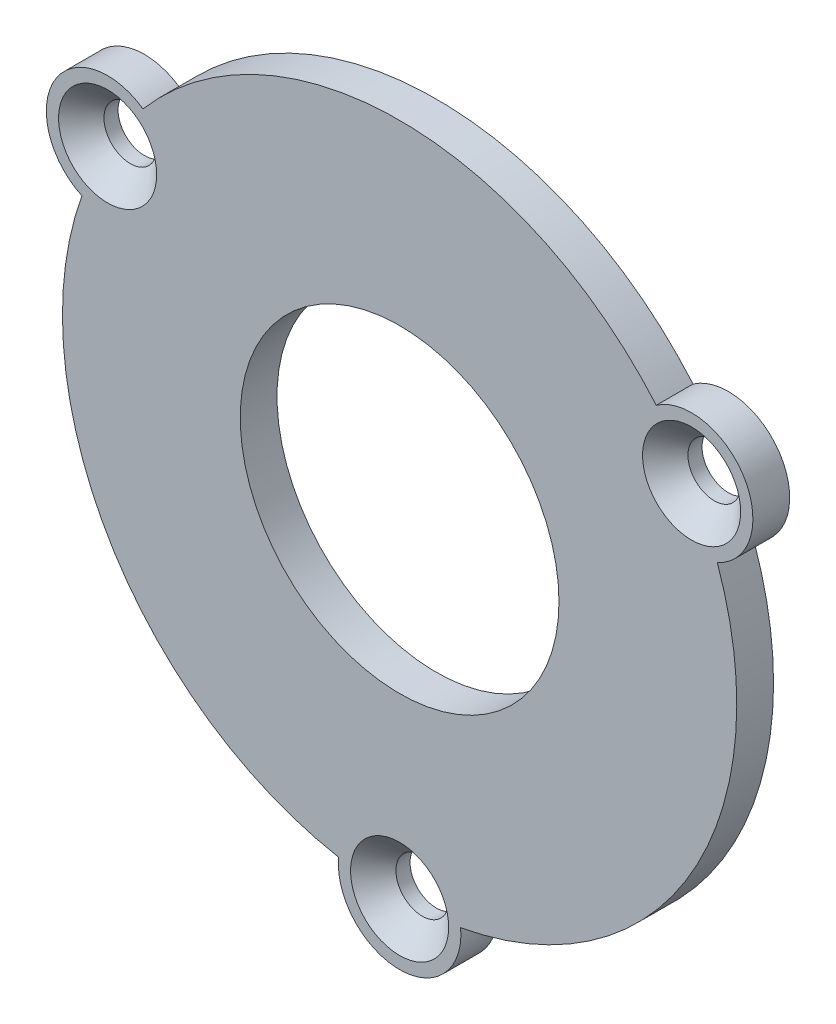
SolidWorks part; units mm, degrees
ref_plane "Plan de face" through (0, 0, 0) normal (0, 0, 1) x (1, 0, 0)
ref_plane "Plan de dessus" through (0, 0, 0) normal (0, 1, 0) x (1, 0, 0)
ref_plane "Plan de droite" through (0, 0, 0) normal (1, 0, 0) x (0, 0, -1)
sketch "Esquisse1" plane through (0, 0, 0) normal (0, 0, 1) x (1, 0, 0)
  circle A0 centre (0, 0) radius 27.5
  circle A1 centre (0, 0) radius 13
  dimension "D1" = 26
  dimension "D2" = 55
extrude "Extrusion1" add sketch "Esquisse1" along normal blind 3
sketch "Esquisse4" plane through (0, 0, 0) normal (0, 0, 1) x (1, 0, 0)
  circle A0 centre (0, -27.5) radius 5
  circle A1 centre (0, 0) radius 27.5 construction
  dimension "D1" = 10
extrude "Extrusion2" add sketch "Esquisse4" along normal up to surface (3 mm away)
hole_wizard "Fraisage pour vis à tête fraisée M42" positions "Esquisse6" profile "Esquisse5" countersink size "M4" standard "Ansi Métrique"
sketch "Esquisse6" plane through (0, 0, 3) normal (0, 0, 1) x (1, 0, 0)
  arc A0 (-4.9793, -27.0455) -> (4.9793, -27.0455) centre (0, -27.5) ccw construction
  point P0 (0, -27.5)
sketch "Esquisse5" plane through (0, -27.5, 3) normal (1, 0, 0) x (0, -1, 0)
  line L0 (0, 0) -> (0, 3)
  line L1 (0, 3) -> (2.15, 3)
  line L2 (2.15, 3) -> (2.15, 1.85)
  line L3 (2.15, 1.85) -> (4, 0)
  line L5 (4, 0) -> (0, 0)
  line L6 (-2.15, 1.85) -> (-4, 0) construction
  line L11 (0, -6.35) -> (0, 107.95) construction
  dimension "Diamètre du perçage jusqu'au prochain" = 4.3
  dimension "Profondeur du perçage jusqu'au prochain" = 3
  dimension "Diamètre du fraisage entrant" = 8
  dimension "Angle du fraisage entrant" = 90
pattern_circular "Répétition circulaire1" count 3 over 360 about axis through (0, 0, 0) along (0, 0, 1) of "Extrusion2", "Fraisage pour vis à tête fraisée M42"
